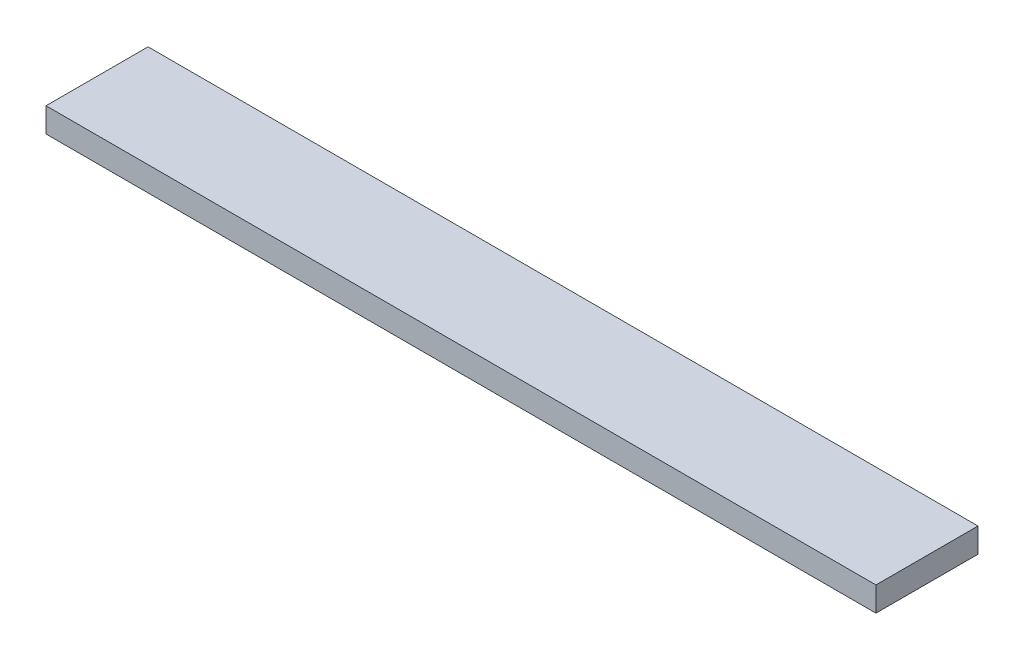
SolidWorks part; units mm, degrees
ref_plane "Front Plane" through (0, 0, 0) normal (0, 0, 1) x (1, 0, 0)
ref_plane "Top Plane" through (0, 0, 0) normal (0, 1, 0) x (1, 0, 0)
ref_plane "Right Plane" through (0, 0, 0) normal (1, 0, 0) x (0, 0, -1)
sketch "Sketch1" plane through (0, 0, 0) normal (0, 0, 1) x (1, 0, 0)
  line L1 (0, 0) -> (423.4343, 0)
  line L2 (0, 0) -> (0, 12.4889)
  line L3 (0, 12.4889) -> (423.4343, 12.4889)
  line L4 (423.4343, 0) -> (423.4343, 12.4889)
extrude "Extrude1" add sketch "Sketch1" along normal blind 52.07
